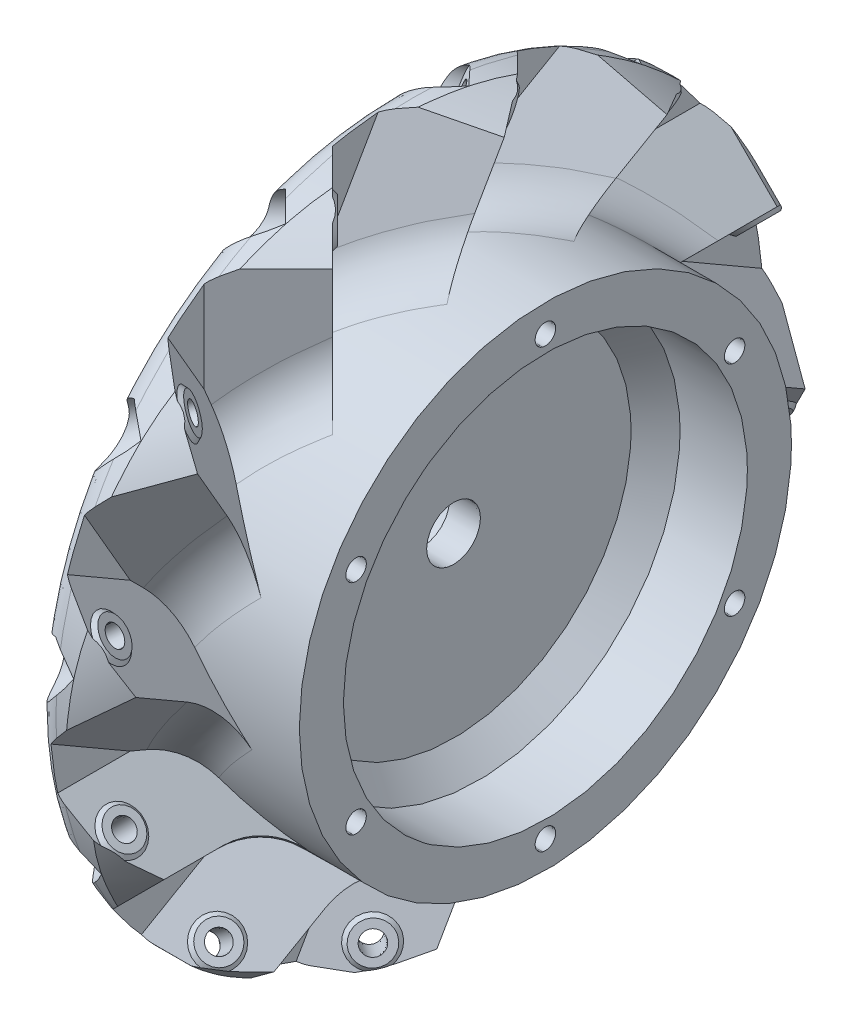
SolidWorks part; units mm, degrees
other "Volumenkörper2[1]"
ref_plane "Alzado" through (0, 0, 0) normal (0, 0, 1) x (1, 0, 0)
ref_plane "Planta" through (0, 0, 0) normal (0, 1, 0) x (1, 0, 0)
ref_plane "Vista lateral" through (0, 0, 0) normal (1, 0, 0) x (0, 0, -1)
imported_body "omniWheel2.stp<1>"
scale "Escala1" scale about centroid uniform scaling yes scale factor 0.75
sketch "Croquis2" plane through (-24.8482, 12.4241, 21.5192) normal (0.7071, -0.3536, -0.6124) x (-0.5477, 0.2739, -0.7906)
  circle A0 centre (44.9263, 46.8951) radius 2.15
  dimension "D1" = 4.3
extrude "Cortar-Extruir1" cut sketch "Croquis2" against normal through all
pattern_circular "MatrizC1" count 12 over 360 about axis through (-7.27, 0, 0) along (1, 0, 0) of "Cortar-Extruir1"
sketch "Croquis3" plane through (-38.6427, 0, 0) normal (-1, 0, 0) x (0, 0, 1)
  circle A0 centre (0, 44.625) radius 2.1
  circle A1 centre (38.6464, 22.3125) radius 2.1
  circle A2 centre (38.6464, -22.3125) radius 2.1
  circle A3 centre (0, -44.625) radius 2.1
  circle A4 centre (-38.6464, -22.3125) radius 2.1
  circle A5 centre (-38.6464, 22.3125) radius 2.1
  point P15 (0, 0)
  dimension "D1" = 4.2
  dimension "D2" = 6
extrude "Cortar-Extruir2" cut sketch "Croquis3" against normal through all
sketch "Croquis4" plane through (-38.6427, 0, 0) normal (-1, 0, 0) x (0, 0, 1)
  circle A0 centre (0, 0) radius 15
  circle A1 centre (0, 0) radius 5.5
  dimension "D1" = 30
  dimension "D2" = 11
extrude "Saliente-Extruir1" add sketch "Croquis4" against normal up to surface (12.6227 mm away)
sketch "Croquis5" plane through (-38.6427, 0, 0) normal (-1, 0, 0) x (0, 0, 1)
  circle A0 centre (0, 0) radius 11.1
  dimension "D1" = 22.2
extrude "Cortar-Extruir3" cut sketch "Croquis5" against normal blind 6.3
chamfer "Chaflán2" distance 5 angle 45 1 edges at (-26.02, 0, 41.25)
